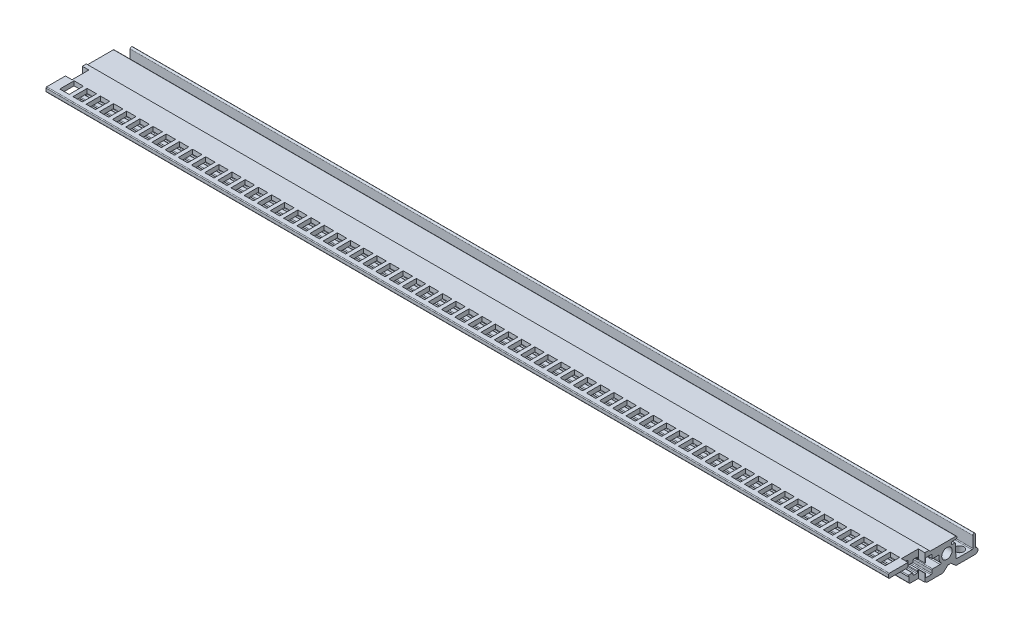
SolidWorks part; units mm, degrees
ref_plane "前视基准面" through (0, 0, 0) normal (0, 0, 1) x (1, 0, 0)
ref_plane "上视基准面" through (0, 0, 0) normal (0, 1, 0) x (1, 0, 0)
ref_plane "右视基准面" through (0, 0, 0) normal (1, 0, 0) x (0, 0, -1)
sketch "草图1" plane through (0, 0, 0) normal (1, 0, 0) x (0, 0, -1)
  line L901 (2.0061, 2.1458) -> (2.0561, 2.1458)
  line L902 (2.2561, 1.9458) -> (2.2561, -0.0542)
  line L903 (2.5561, -0.3542) -> (6.0561, -0.3542)
  line L904 (6.546, -0.7542) -> (12.6401, -0.7542)
  line L905 (12.8419, -0.6762) -> (14.6823, 0.9969)
  line L906 (15.8298, 0.9969) -> (17.6702, -0.6762)
  line L907 (17.872, -0.7542) -> (25.1561, -0.7542)
  line L908 (25.2561, 1.6874) -> (25.2561, 6.0458)
  line L909 (24.2561, 6.0458) -> (24.2561, 1.7458)
  line L910 (23.9561, 1.4458) -> (18.0561, 1.4458)
  line L911 (17.7561, 1.7458) -> (17.7561, 3.0993)
  line L912 (17.5561, 3.4458) -> (17.5561, 6.7458)
  line L913 (17.2561, 7.0458) -> (16.3561, 7.0458)
  line L914 (16.0561, 7.3458) -> (16.0561, 7.7458)
  line L915 (16.3561, 8.0458) -> (17.7561, 8.0458)
  line L916 (18.0561, 8.3458) -> (18.0561, 8.7458)
  line L917 (17.7561, 9.0458) -> (-7.9439, 9.0458)
  line L918 (-8.2439, 8.7458) -> (-8.2439, 8.1458)
  line L919 (-7.9439, 7.8458) -> (1.4561, 7.8458)
  line L920 (1.7561, 7.5458) -> (1.7561, 6.3458)
  line L921 (2.0561, 6.0458) -> (3.4561, 6.0458)
  line L922 (3.7561, 6.3458) -> (3.7561, 6.7458)
  line L923 (4.0561, 7.0458) -> (5.1561, 7.0458)
  line L924 (5.4561, 6.7458) -> (5.4561, 6.3458)
  line L925 (6.0561, 6.3458) -> (6.0561, 7.4058)
  line L926 (6.3561, 7.7058) -> (8.1561, 7.7058)
  line L927 (8.4561, 7.4058) -> (8.4561, 6.3458)
  line L928 (8.7561, 6.0458) -> (10.98, 6.0458)
  line L929 (11.646, 2.6458) -> (8.7561, 2.6458)
  line L930 (8.4561, 2.3458) -> (8.4561, 1.2858)
  line L931 (8.1561, 0.9858) -> (6.3561, 0.9858)
  line L932 (6.0561, 1.2858) -> (6.0561, 2.3458)
  line L933 (5.4561, 2.3458) -> (5.4561, 1.9458)
  line L934 (5.1561, 1.6458) -> (4.0561, 1.6458)
  line L935 (3.7561, 1.9458) -> (3.7561, 2.3458)
  line L936 (3.4561, 2.6458) -> (2.0061, 2.6458)
  circle A0 centre (14.2561, 5.0458) radius 2
  arc A133 (2.0061, 2.6458) -> (2.0061, 2.1458) centre (2.0061, 2.3958) ccw
  arc A134 (2.2561, 1.9458) -> (2.0561, 2.1458) centre (2.0561, 1.9458) ccw
  arc A135 (2.2561, -0.0542) -> (2.5561, -0.3542) centre (2.5561, -0.0542) ccw
  arc A136 (6.35, -0.5942) -> (6.0561, -0.3542) centre (6.0561, -0.6542) ccw
  arc A137 (6.35, -0.5942) -> (6.546, -0.7542) centre (6.546, -0.5542) ccw
  arc A138 (12.6401, -0.7542) -> (12.8419, -0.6762) centre (12.6401, -0.4542) ccw
  arc A139 (15.0701, 1.0103) -> (14.6823, 0.9969) centre (14.8841, 0.7749) ccw
  arc A140 (15.0701, 1.0103) -> (15.442, 1.0103) centre (15.2561, 1.2458) ccw
  arc A141 (15.8298, 0.9969) -> (15.442, 1.0103) centre (15.628, 0.7749) ccw
  arc A142 (17.6702, -0.6762) -> (17.872, -0.7542) centre (17.872, -0.4542) ccw
  arc A143 (25.1561, -0.7542) -> (25.4703, 1.3999) centre (25.1561, 0.3458) ccw
  arc A144 (25.2561, 1.6874) -> (25.4703, 1.3999) centre (25.5561, 1.6874) ccw
  arc A145 (25.2561, 6.0458) -> (24.2561, 6.0458) centre (24.7561, 6.0458) ccw
  arc A146 (23.9561, 1.4458) -> (24.2561, 1.7458) centre (23.9561, 1.7458) ccw
  arc A147 (17.7561, 1.7458) -> (18.0561, 1.4458) centre (18.0561, 1.7458) ccw
  arc A148 (17.7561, 3.0993) -> (17.6561, 3.2726) centre (17.5561, 3.0993) ccw
  arc A149 (17.5561, 3.4458) -> (17.6561, 3.2726) centre (17.7561, 3.4458) ccw
  arc A150 (17.5561, 6.7458) -> (17.2561, 7.0458) centre (17.2561, 6.7458) ccw
  arc A151 (16.0561, 7.3458) -> (16.3561, 7.0458) centre (16.3561, 7.3458) ccw
  arc A152 (16.3561, 8.0458) -> (16.0561, 7.7458) centre (16.3561, 7.7458) ccw
  arc A153 (17.7561, 8.0458) -> (18.0561, 8.3458) centre (17.7561, 8.3458) ccw
  arc A154 (18.0561, 8.7458) -> (17.7561, 9.0458) centre (17.7561, 8.7458) ccw
  arc A155 (-7.9439, 9.0458) -> (-8.2439, 8.7458) centre (-7.9439, 8.7458) ccw
  arc A156 (-8.2439, 8.1458) -> (-7.9439, 7.8458) centre (-7.9439, 8.1458) ccw
  arc A157 (1.7561, 7.5458) -> (1.4561, 7.8458) centre (1.4561, 7.5458) ccw
  arc A158 (1.7561, 6.3458) -> (2.0561, 6.0458) centre (2.0561, 6.3458) ccw
  arc A159 (3.4561, 6.0458) -> (3.7561, 6.3458) centre (3.4561, 6.3458) ccw
  arc A160 (4.0561, 7.0458) -> (3.7561, 6.7458) centre (4.0561, 6.7458) ccw
  arc A161 (5.4561, 6.7458) -> (5.1561, 7.0458) centre (5.1561, 6.7458) ccw
  arc A162 (5.4561, 6.3458) -> (6.0561, 6.3458) centre (5.7561, 6.3458) ccw
  arc A163 (6.3561, 7.7058) -> (6.0561, 7.4058) centre (6.3561, 7.4058) ccw
  arc A164 (8.4561, 7.4058) -> (8.1561, 7.7058) centre (8.1561, 7.4058) ccw
  arc A165 (8.4561, 6.3458) -> (8.7561, 6.0458) centre (8.7561, 6.3458) ccw
  arc A166 (11.2734, 5.6831) -> (10.98, 6.0458) centre (10.98, 5.7458) ccw
  arc A167 (11.2734, 5.6831) -> (11.8797, 3.1338) centre (14.2561, 5.0458) ccw
  arc A168 (11.646, 2.6458) -> (11.8797, 3.1338) centre (11.646, 2.9458) ccw
  arc A169 (8.7561, 2.6458) -> (8.4561, 2.3458) centre (8.7561, 2.3458) ccw
  arc A170 (8.1561, 0.9858) -> (8.4561, 1.2858) centre (8.1561, 1.2858) ccw
  arc A171 (6.0561, 1.2858) -> (6.3561, 0.9858) centre (6.3561, 1.2858) ccw
  arc A172 (6.0561, 2.3458) -> (5.4561, 2.3458) centre (5.7561, 2.3458) ccw
  arc A173 (5.1561, 1.6458) -> (5.4561, 1.9458) centre (5.1561, 1.9458) ccw
  arc A174 (3.7561, 1.9458) -> (4.0561, 1.6458) centre (4.0561, 1.9458) ccw
  arc A175 (3.7561, 2.3458) -> (3.4561, 2.6458) centre (3.4561, 2.3458) ccw
  dimension "D2" = 0.3
  dimension "D3" = 0.3
  dimension "D6" = 4
  dimension "D1" = 0.6
  dimension "D4" = 25.7
  dimension "D5" = 9.4
extrude "凸台-拉伸1" add sketch "草图1" along normal mid plane 325.12
sketch "草图7" plane through (162.56, 0, 0) normal (1, 0, 0) x (0, 0, -1)
  line L0 (-7.9439, 9.0458) -> (-8.2439, 9.0458)
  line L1 (-8.2439, 9.0458) -> (-8.2439, 8.7458)
  arc A0 (-7.9439, 9.0458) -> (-8.2439, 8.7458) centre (-7.9439, 8.7458) ccw construction
  arc A1 (-7.9439, 9.0458) -> (-8.2439, 8.7458) centre (-7.9439, 8.7458) ccw
extrude "凸台-拉伸4" add sketch "草图7" against normal through all
sketch "草图6" plane through (-162.56, 0, 0) normal (-1, 0, 0) x (0, 0, 1)
  line L0 (-7.8061, 9.0458) -> (8.2439, 9.0458)
  line L1 (-17.7561, 9.0458) -> (8.2439, 9.0458) construction
  line L4 (8.2439, 9.0458) -> (8.2439, 9.5458)
  line L5 (8.2439, 9.5458) -> (-7.3061, 9.5458)
  line L6 (-7.3061, 9.5458) -> (-7.8061, 9.0458)
extrude "凸台-拉伸3" add sketch "草图6" against normal through all
sketch "草图3" plane through (0, 9.5458, 0) normal (0, 1, 0) x (1, 0, 0)
  line L0 (162.56, 17.7561) -> (162.56, 7.8061) construction
  line L1 (162.56, 5.7561) -> (160.02, 5.7561)
  line L2 (162.56, 5.7561) -> (162.56, -0.7439)
  line L3 (162.56, -0.7439) -> (160.02, -0.7439)
  line L4 (160.02, 5.7561) -> (160.02, -0.7439)
  line L5 (162.56, -8.2439) -> (-162.56, -8.2439) construction
  line L7 (0, -8.2439) -> (0, 17.7561) construction
  line L9 (162.56, 17.7561) -> (-162.56, 17.7561) construction
  line L10 (-160.02, 5.7561) -> (-160.02, -0.7439)
  line L11 (-162.56, -0.7439) -> (-160.02, -0.7439)
  line L12 (-162.56, 5.7561) -> (-162.56, -0.7439)
  line L13 (-162.56, 5.7561) -> (-160.02, 5.7561)
  dimension "D1" = 2.54
  dimension "D2" = 7.5
  dimension "D3" = 6.5
extrude "切除-拉伸1" cut sketch "草图3" against normal up to surface (10.3 mm away)
sketch "草图4" plane through (0, -0.7542, 0) normal (0, -1, 0) x (-1, 0, 0)
  line L0 (-160.02, 1.7561) -> (160.02, 1.7561) construction
  line L1 (-162.56, 17.872) -> (-162.56, 25.1561) construction
  circle A0 centre (-160.02, 21.7061) radius 1.65
  circle A1 centre (-154.94, 21.7061) radius 1.65
  circle A2 centre (-149.86, 21.7061) radius 1.65
  circle A3 centre (-144.78, 21.7061) radius 1.65
  circle A4 centre (-139.7, 21.7061) radius 1.65
  circle A5 centre (-134.62, 21.7061) radius 1.65
  circle A6 centre (-129.54, 21.7061) radius 1.65
  circle A7 centre (-124.46, 21.7061) radius 1.65
  circle A8 centre (-119.38, 21.7061) radius 1.65
  circle A9 centre (-114.3, 21.7061) radius 1.65
  circle A10 centre (-109.22, 21.7061) radius 1.65
  circle A11 centre (-104.14, 21.7061) radius 1.65
  circle A12 centre (-99.06, 21.7061) radius 1.65
  circle A13 centre (-93.98, 21.7061) radius 1.65
  circle A14 centre (-88.9, 21.7061) radius 1.65
  circle A15 centre (-83.82, 21.7061) radius 1.65
  circle A16 centre (-78.74, 21.7061) radius 1.65
  circle A17 centre (-73.66, 21.7061) radius 1.65
  circle A18 centre (-68.58, 21.7061) radius 1.65
  circle A19 centre (-63.5, 21.7061) radius 1.65
  circle A20 centre (-58.42, 21.7061) radius 1.65
  circle A21 centre (-53.34, 21.7061) radius 1.65
  circle A22 centre (-48.26, 21.7061) radius 1.65
  circle A23 centre (-43.18, 21.7061) radius 1.65
  circle A24 centre (-38.1, 21.7061) radius 1.65
  circle A25 centre (-33.02, 21.7061) radius 1.65
  circle A26 centre (-27.94, 21.7061) radius 1.65
  circle A27 centre (-22.86, 21.7061) radius 1.65
  circle A28 centre (-17.78, 21.7061) radius 1.65
  circle A29 centre (-12.7, 21.7061) radius 1.65
  circle A30 centre (-7.62, 21.7061) radius 1.65
  circle A31 centre (-2.54, 21.7061) radius 1.65
  circle A32 centre (2.54, 21.7061) radius 1.65
  circle A33 centre (7.62, 21.7061) radius 1.65
  circle A34 centre (12.7, 21.7061) radius 1.65
  circle A35 centre (17.78, 21.7061) radius 1.65
  circle A36 centre (22.86, 21.7061) radius 1.65
  circle A37 centre (27.94, 21.7061) radius 1.65
  circle A38 centre (33.02, 21.7061) radius 1.65
  circle A39 centre (38.1, 21.7061) radius 1.65
  circle A40 centre (43.18, 21.7061) radius 1.65
  circle A41 centre (48.26, 21.7061) radius 1.65
  circle A42 centre (53.34, 21.7061) radius 1.65
  circle A43 centre (58.42, 21.7061) radius 1.65
  circle A44 centre (63.5, 21.7061) radius 1.65
  circle A45 centre (68.58, 21.7061) radius 1.65
  circle A46 centre (73.66, 21.7061) radius 1.65
  circle A47 centre (78.74, 21.7061) radius 1.65
  circle A48 centre (83.82, 21.7061) radius 1.65
  circle A49 centre (88.9, 21.7061) radius 1.65
  circle A50 centre (93.98, 21.7061) radius 1.65
  circle A51 centre (99.06, 21.7061) radius 1.65
  circle A52 centre (104.14, 21.7061) radius 1.65
  circle A53 centre (109.22, 21.7061) radius 1.65
  circle A54 centre (114.3, 21.7061) radius 1.65
  circle A55 centre (119.38, 21.7061) radius 1.65
  circle A56 centre (124.46, 21.7061) radius 1.65
  circle A57 centre (129.54, 21.7061) radius 1.65
  circle A58 centre (134.62, 21.7061) radius 1.65
  circle A59 centre (139.7, 21.7061) radius 1.65
  circle A60 centre (144.78, 21.7061) radius 1.65
  circle A61 centre (149.86, 21.7061) radius 1.65
  circle A62 centre (154.94, 21.7061) radius 1.65
  circle A63 centre (160.02, 21.7061) radius 1.65
extrude "切除-拉伸2" cut sketch "草图4" against normal up to surface (9.8 mm away)
sketch "草图5" plane through (0, 9.5458, 0) normal (0, 1, 0) x (1, 0, 0)
  line L0 (-162.56, 17.7561) -> (-162.56, 7.8061) construction
  line L1 (-155.68, -6.1939) -> (-159.28, -6.1939)
  line L2 (-155.68, -6.1939) -> (-155.68, -0.6939)
  line L3 (-155.68, -0.6939) -> (-159.28, -0.6939)
  line L4 (-159.28, -6.1939) -> (-159.28, -0.6939)
  line L5 (-155.68, -6.1939) -> (-159.28, -0.6939) construction
  line L6 (-155.68, -0.6939) -> (-159.28, -6.1939) construction
  line L8 (-150.6, -6.1939) -> (-154.2, -6.1939)
  line L9 (-150.6, -6.1939) -> (-150.6, -0.6939)
  line L10 (-150.6, -0.6939) -> (-154.2, -0.6939)
  line L11 (-154.2, -6.1939) -> (-154.2, -0.6939)
  line L12 (-150.6, -6.1939) -> (-154.2, -0.6939) construction
  line L13 (-150.6, -0.6939) -> (-154.2, -6.1939) construction
  line L14 (-145.52, -6.1939) -> (-149.12, -6.1939)
  line L15 (-145.52, -6.1939) -> (-145.52, -0.6939)
  line L16 (-145.52, -0.6939) -> (-149.12, -0.6939)
  line L17 (-149.12, -6.1939) -> (-149.12, -0.6939)
  line L18 (-145.52, -6.1939) -> (-149.12, -0.6939) construction
  line L19 (-145.52, -0.6939) -> (-149.12, -6.1939) construction
  line L20 (-140.44, -6.1939) -> (-144.04, -6.1939)
  line L21 (-140.44, -6.1939) -> (-140.44, -0.6939)
  line L22 (-140.44, -0.6939) -> (-144.04, -0.6939)
  line L23 (-144.04, -6.1939) -> (-144.04, -0.6939)
  line L24 (-140.44, -6.1939) -> (-144.04, -0.6939) construction
  line L25 (-140.44, -0.6939) -> (-144.04, -6.1939) construction
  line L26 (-135.36, -6.1939) -> (-138.96, -6.1939)
  line L27 (-135.36, -6.1939) -> (-135.36, -0.6939)
  line L28 (-135.36, -0.6939) -> (-138.96, -0.6939)
  line L29 (-138.96, -6.1939) -> (-138.96, -0.6939)
  line L30 (-135.36, -6.1939) -> (-138.96, -0.6939) construction
  line L31 (-135.36, -0.6939) -> (-138.96, -6.1939) construction
  line L32 (-130.28, -6.1939) -> (-133.88, -6.1939)
  line L33 (-130.28, -6.1939) -> (-130.28, -0.6939)
  line L34 (-130.28, -0.6939) -> (-133.88, -0.6939)
  line L35 (-133.88, -6.1939) -> (-133.88, -0.6939)
  line L36 (-130.28, -6.1939) -> (-133.88, -0.6939) construction
  line L37 (-130.28, -0.6939) -> (-133.88, -6.1939) construction
  line L38 (-125.2, -6.1939) -> (-128.8, -6.1939)
  line L39 (-125.2, -6.1939) -> (-125.2, -0.6939)
  line L40 (-125.2, -0.6939) -> (-128.8, -0.6939)
  line L41 (-128.8, -6.1939) -> (-128.8, -0.6939)
  line L42 (-125.2, -6.1939) -> (-128.8, -0.6939) construction
  line L43 (-125.2, -0.6939) -> (-128.8, -6.1939) construction
  line L44 (-120.12, -6.1939) -> (-123.72, -6.1939)
  line L45 (-120.12, -6.1939) -> (-120.12, -0.6939)
  line L46 (-120.12, -0.6939) -> (-123.72, -0.6939)
  line L47 (-123.72, -6.1939) -> (-123.72, -0.6939)
  line L48 (-120.12, -6.1939) -> (-123.72, -0.6939) construction
  line L49 (-120.12, -0.6939) -> (-123.72, -6.1939) construction
  line L50 (-115.04, -6.1939) -> (-118.64, -6.1939)
  line L51 (-115.04, -6.1939) -> (-115.04, -0.6939)
  line L52 (-115.04, -0.6939) -> (-118.64, -0.6939)
  line L53 (-118.64, -6.1939) -> (-118.64, -0.6939)
  line L54 (-115.04, -6.1939) -> (-118.64, -0.6939) construction
  line L55 (-115.04, -0.6939) -> (-118.64, -6.1939) construction
  line L56 (-109.96, -6.1939) -> (-113.56, -6.1939)
  line L57 (-109.96, -6.1939) -> (-109.96, -0.6939)
  line L58 (-109.96, -0.6939) -> (-113.56, -0.6939)
  line L59 (-113.56, -6.1939) -> (-113.56, -0.6939)
  line L60 (-109.96, -6.1939) -> (-113.56, -0.6939) construction
  line L61 (-109.96, -0.6939) -> (-113.56, -6.1939) construction
  line L62 (-104.88, -6.1939) -> (-108.48, -6.1939)
  line L63 (-104.88, -6.1939) -> (-104.88, -0.6939)
  line L64 (-104.88, -0.6939) -> (-108.48, -0.6939)
  line L65 (-108.48, -6.1939) -> (-108.48, -0.6939)
  line L66 (-104.88, -6.1939) -> (-108.48, -0.6939) construction
  line L67 (-104.88, -0.6939) -> (-108.48, -6.1939) construction
  line L68 (-99.8, -6.1939) -> (-103.4, -6.1939)
  line L69 (-99.8, -6.1939) -> (-99.8, -0.6939)
  line L70 (-99.8, -0.6939) -> (-103.4, -0.6939)
  line L71 (-103.4, -6.1939) -> (-103.4, -0.6939)
  line L72 (-99.8, -6.1939) -> (-103.4, -0.6939) construction
  line L73 (-99.8, -0.6939) -> (-103.4, -6.1939) construction
  line L74 (-94.72, -6.1939) -> (-98.32, -6.1939)
  line L75 (-94.72, -6.1939) -> (-94.72, -0.6939)
  line L76 (-94.72, -0.6939) -> (-98.32, -0.6939)
  line L77 (-98.32, -6.1939) -> (-98.32, -0.6939)
  line L78 (-94.72, -6.1939) -> (-98.32, -0.6939) construction
  line L79 (-94.72, -0.6939) -> (-98.32, -6.1939) construction
  line L80 (-89.64, -6.1939) -> (-93.24, -6.1939)
  line L81 (-89.64, -6.1939) -> (-89.64, -0.6939)
  line L82 (-89.64, -0.6939) -> (-93.24, -0.6939)
  line L83 (-93.24, -6.1939) -> (-93.24, -0.6939)
  line L84 (-89.64, -6.1939) -> (-93.24, -0.6939) construction
  line L85 (-89.64, -0.6939) -> (-93.24, -6.1939) construction
  line L86 (-84.56, -6.1939) -> (-88.16, -6.1939)
  line L87 (-84.56, -6.1939) -> (-84.56, -0.6939)
  line L88 (-84.56, -0.6939) -> (-88.16, -0.6939)
  line L89 (-88.16, -6.1939) -> (-88.16, -0.6939)
  line L90 (-84.56, -6.1939) -> (-88.16, -0.6939) construction
  line L91 (-84.56, -0.6939) -> (-88.16, -6.1939) construction
  line L92 (-79.48, -6.1939) -> (-83.08, -6.1939)
  line L93 (-79.48, -6.1939) -> (-79.48, -0.6939)
  line L94 (-79.48, -0.6939) -> (-83.08, -0.6939)
  line L95 (-83.08, -6.1939) -> (-83.08, -0.6939)
  line L96 (-79.48, -6.1939) -> (-83.08, -0.6939) construction
  line L97 (-79.48, -0.6939) -> (-83.08, -6.1939) construction
  line L98 (-74.4, -6.1939) -> (-78, -6.1939)
  line L99 (-74.4, -6.1939) -> (-74.4, -0.6939)
  line L100 (-74.4, -0.6939) -> (-78, -0.6939)
  line L101 (-78, -6.1939) -> (-78, -0.6939)
  line L102 (-74.4, -6.1939) -> (-78, -0.6939) construction
  line L103 (-74.4, -0.6939) -> (-78, -6.1939) construction
  line L104 (-69.32, -6.1939) -> (-72.92, -6.1939)
  line L105 (-69.32, -6.1939) -> (-69.32, -0.6939)
  line L106 (-69.32, -0.6939) -> (-72.92, -0.6939)
  line L107 (-72.92, -6.1939) -> (-72.92, -0.6939)
  line L108 (-69.32, -6.1939) -> (-72.92, -0.6939) construction
  line L109 (-69.32, -0.6939) -> (-72.92, -6.1939) construction
  line L110 (-64.24, -6.1939) -> (-67.84, -6.1939)
  line L111 (-64.24, -6.1939) -> (-64.24, -0.6939)
  line L112 (-64.24, -0.6939) -> (-67.84, -0.6939)
  line L113 (-67.84, -6.1939) -> (-67.84, -0.6939)
  line L114 (-64.24, -6.1939) -> (-67.84, -0.6939) construction
  line L115 (-64.24, -0.6939) -> (-67.84, -6.1939) construction
  line L116 (-59.16, -6.1939) -> (-62.76, -6.1939)
  line L117 (-59.16, -6.1939) -> (-59.16, -0.6939)
  line L118 (-59.16, -0.6939) -> (-62.76, -0.6939)
  line L119 (-62.76, -6.1939) -> (-62.76, -0.6939)
  line L120 (-59.16, -6.1939) -> (-62.76, -0.6939) construction
  line L121 (-59.16, -0.6939) -> (-62.76, -6.1939) construction
  line L122 (-54.08, -6.1939) -> (-57.68, -6.1939)
  line L123 (-54.08, -6.1939) -> (-54.08, -0.6939)
  line L124 (-54.08, -0.6939) -> (-57.68, -0.6939)
  line L125 (-57.68, -6.1939) -> (-57.68, -0.6939)
  line L126 (-54.08, -6.1939) -> (-57.68, -0.6939) construction
  line L127 (-54.08, -0.6939) -> (-57.68, -6.1939) construction
  line L128 (-49, -6.1939) -> (-52.6, -6.1939)
  line L129 (-49, -6.1939) -> (-49, -0.6939)
  line L130 (-49, -0.6939) -> (-52.6, -0.6939)
  line L131 (-52.6, -6.1939) -> (-52.6, -0.6939)
  line L132 (-49, -6.1939) -> (-52.6, -0.6939) construction
  line L133 (-49, -0.6939) -> (-52.6, -6.1939) construction
  line L134 (-43.92, -6.1939) -> (-47.52, -6.1939)
  line L135 (-43.92, -6.1939) -> (-43.92, -0.6939)
  line L136 (-43.92, -0.6939) -> (-47.52, -0.6939)
  line L137 (-47.52, -6.1939) -> (-47.52, -0.6939)
  line L138 (-43.92, -6.1939) -> (-47.52, -0.6939) construction
  line L139 (-43.92, -0.6939) -> (-47.52, -6.1939) construction
  line L140 (-38.84, -6.1939) -> (-42.44, -6.1939)
  line L141 (-38.84, -6.1939) -> (-38.84, -0.6939)
  line L142 (-38.84, -0.6939) -> (-42.44, -0.6939)
  line L143 (-42.44, -6.1939) -> (-42.44, -0.6939)
  line L144 (-38.84, -6.1939) -> (-42.44, -0.6939) construction
  line L145 (-38.84, -0.6939) -> (-42.44, -6.1939) construction
  line L146 (-33.76, -6.1939) -> (-37.36, -6.1939)
  line L147 (-33.76, -6.1939) -> (-33.76, -0.6939)
  line L148 (-33.76, -0.6939) -> (-37.36, -0.6939)
  line L149 (-37.36, -6.1939) -> (-37.36, -0.6939)
  line L150 (-33.76, -6.1939) -> (-37.36, -0.6939) construction
  line L151 (-33.76, -0.6939) -> (-37.36, -6.1939) construction
  line L152 (-28.68, -6.1939) -> (-32.28, -6.1939)
  line L153 (-28.68, -6.1939) -> (-28.68, -0.6939)
  line L154 (-28.68, -0.6939) -> (-32.28, -0.6939)
  line L155 (-32.28, -6.1939) -> (-32.28, -0.6939)
  line L156 (-28.68, -6.1939) -> (-32.28, -0.6939) construction
  line L157 (-28.68, -0.6939) -> (-32.28, -6.1939) construction
  line L158 (-23.6, -6.1939) -> (-27.2, -6.1939)
  line L159 (-23.6, -6.1939) -> (-23.6, -0.6939)
  line L160 (-23.6, -0.6939) -> (-27.2, -0.6939)
  line L161 (-27.2, -6.1939) -> (-27.2, -0.6939)
  line L162 (-23.6, -6.1939) -> (-27.2, -0.6939) construction
  line L163 (-23.6, -0.6939) -> (-27.2, -6.1939) construction
  line L164 (-18.52, -6.1939) -> (-22.12, -6.1939)
  line L165 (-18.52, -6.1939) -> (-18.52, -0.6939)
  line L166 (-18.52, -0.6939) -> (-22.12, -0.6939)
  line L167 (-22.12, -6.1939) -> (-22.12, -0.6939)
  line L168 (-18.52, -6.1939) -> (-22.12, -0.6939) construction
  line L169 (-18.52, -0.6939) -> (-22.12, -6.1939) construction
  line L170 (-13.44, -6.1939) -> (-17.04, -6.1939)
  line L171 (-13.44, -6.1939) -> (-13.44, -0.6939)
  line L172 (-13.44, -0.6939) -> (-17.04, -0.6939)
  line L173 (-17.04, -6.1939) -> (-17.04, -0.6939)
  line L174 (-13.44, -6.1939) -> (-17.04, -0.6939) construction
  line L175 (-13.44, -0.6939) -> (-17.04, -6.1939) construction
  line L176 (-8.36, -6.1939) -> (-11.96, -6.1939)
  line L177 (-8.36, -6.1939) -> (-8.36, -0.6939)
  line L178 (-8.36, -0.6939) -> (-11.96, -0.6939)
  line L179 (-11.96, -6.1939) -> (-11.96, -0.6939)
  line L180 (-8.36, -6.1939) -> (-11.96, -0.6939) construction
  line L181 (-8.36, -0.6939) -> (-11.96, -6.1939) construction
  line L182 (-3.28, -6.1939) -> (-6.88, -6.1939)
  line L183 (-3.28, -6.1939) -> (-3.28, -0.6939)
  line L184 (-3.28, -0.6939) -> (-6.88, -0.6939)
  line L185 (-6.88, -6.1939) -> (-6.88, -0.6939)
  line L186 (-3.28, -6.1939) -> (-6.88, -0.6939) construction
  line L187 (-3.28, -0.6939) -> (-6.88, -6.1939) construction
  line L188 (1.8, -6.1939) -> (-1.8, -6.1939)
  line L189 (1.8, -6.1939) -> (1.8, -0.6939)
  line L190 (1.8, -0.6939) -> (-1.8, -0.6939)
  line L191 (-1.8, -6.1939) -> (-1.8, -0.6939)
  line L192 (1.8, -6.1939) -> (-1.8, -0.6939) construction
  line L193 (1.8, -0.6939) -> (-1.8, -6.1939) construction
  line L194 (6.88, -6.1939) -> (3.28, -6.1939)
  line L195 (6.88, -6.1939) -> (6.88, -0.6939)
  line L196 (6.88, -0.6939) -> (3.28, -0.6939)
  line L197 (3.28, -6.1939) -> (3.28, -0.6939)
  line L198 (6.88, -6.1939) -> (3.28, -0.6939) construction
  line L199 (6.88, -0.6939) -> (3.28, -6.1939) construction
  line L200 (11.96, -6.1939) -> (8.36, -6.1939)
  line L201 (11.96, -6.1939) -> (11.96, -0.6939)
  line L202 (11.96, -0.6939) -> (8.36, -0.6939)
  line L203 (8.36, -6.1939) -> (8.36, -0.6939)
  line L204 (11.96, -6.1939) -> (8.36, -0.6939) construction
  line L205 (11.96, -0.6939) -> (8.36, -6.1939) construction
  line L206 (17.04, -6.1939) -> (13.44, -6.1939)
  line L207 (17.04, -6.1939) -> (17.04, -0.6939)
  line L208 (17.04, -0.6939) -> (13.44, -0.6939)
  line L209 (13.44, -6.1939) -> (13.44, -0.6939)
  line L210 (17.04, -6.1939) -> (13.44, -0.6939) construction
  line L211 (17.04, -0.6939) -> (13.44, -6.1939) construction
  line L212 (22.12, -6.1939) -> (18.52, -6.1939)
  line L213 (22.12, -6.1939) -> (22.12, -0.6939)
  line L214 (22.12, -0.6939) -> (18.52, -0.6939)
  line L215 (18.52, -6.1939) -> (18.52, -0.6939)
  line L216 (22.12, -6.1939) -> (18.52, -0.6939) construction
  line L217 (22.12, -0.6939) -> (18.52, -6.1939) construction
  line L218 (27.2, -6.1939) -> (23.6, -6.1939)
  line L219 (27.2, -6.1939) -> (27.2, -0.6939)
  line L220 (27.2, -0.6939) -> (23.6, -0.6939)
  line L221 (23.6, -6.1939) -> (23.6, -0.6939)
  line L222 (27.2, -6.1939) -> (23.6, -0.6939) construction
  line L223 (27.2, -0.6939) -> (23.6, -6.1939) construction
  line L224 (32.28, -6.1939) -> (28.68, -6.1939)
  line L225 (32.28, -6.1939) -> (32.28, -0.6939)
  line L226 (32.28, -0.6939) -> (28.68, -0.6939)
  line L227 (28.68, -6.1939) -> (28.68, -0.6939)
  line L228 (32.28, -6.1939) -> (28.68, -0.6939) construction
  line L229 (32.28, -0.6939) -> (28.68, -6.1939) construction
  line L230 (37.36, -6.1939) -> (33.76, -6.1939)
  line L231 (37.36, -6.1939) -> (37.36, -0.6939)
  line L232 (37.36, -0.6939) -> (33.76, -0.6939)
  line L233 (33.76, -6.1939) -> (33.76, -0.6939)
  line L234 (37.36, -6.1939) -> (33.76, -0.6939) construction
  line L235 (37.36, -0.6939) -> (33.76, -6.1939) construction
  line L236 (42.44, -6.1939) -> (38.84, -6.1939)
  line L237 (42.44, -6.1939) -> (42.44, -0.6939)
  line L238 (42.44, -0.6939) -> (38.84, -0.6939)
  line L239 (38.84, -6.1939) -> (38.84, -0.6939)
  line L240 (42.44, -6.1939) -> (38.84, -0.6939) construction
  line L241 (42.44, -0.6939) -> (38.84, -6.1939) construction
  line L242 (47.52, -6.1939) -> (43.92, -6.1939)
  line L243 (47.52, -6.1939) -> (47.52, -0.6939)
  line L244 (47.52, -0.6939) -> (43.92, -0.6939)
  line L245 (43.92, -6.1939) -> (43.92, -0.6939)
  line L246 (47.52, -6.1939) -> (43.92, -0.6939) construction
  line L247 (47.52, -0.6939) -> (43.92, -6.1939) construction
  line L248 (52.6, -6.1939) -> (49, -6.1939)
  line L249 (52.6, -6.1939) -> (52.6, -0.6939)
  line L250 (52.6, -0.6939) -> (49, -0.6939)
  line L251 (49, -6.1939) -> (49, -0.6939)
  line L252 (52.6, -6.1939) -> (49, -0.6939) construction
  line L253 (52.6, -0.6939) -> (49, -6.1939) construction
  line L254 (57.68, -6.1939) -> (54.08, -6.1939)
  line L255 (57.68, -6.1939) -> (57.68, -0.6939)
  line L256 (57.68, -0.6939) -> (54.08, -0.6939)
  line L257 (54.08, -6.1939) -> (54.08, -0.6939)
  line L258 (57.68, -6.1939) -> (54.08, -0.6939) construction
  line L259 (57.68, -0.6939) -> (54.08, -6.1939) construction
  line L260 (62.76, -6.1939) -> (59.16, -6.1939)
  line L261 (62.76, -6.1939) -> (62.76, -0.6939)
  line L262 (62.76, -0.6939) -> (59.16, -0.6939)
  line L263 (59.16, -6.1939) -> (59.16, -0.6939)
  line L264 (62.76, -6.1939) -> (59.16, -0.6939) construction
  line L265 (62.76, -0.6939) -> (59.16, -6.1939) construction
  line L266 (67.84, -6.1939) -> (64.24, -6.1939)
  line L267 (67.84, -6.1939) -> (67.84, -0.6939)
  line L268 (67.84, -0.6939) -> (64.24, -0.6939)
  line L269 (64.24, -6.1939) -> (64.24, -0.6939)
  line L270 (67.84, -6.1939) -> (64.24, -0.6939) construction
  line L271 (67.84, -0.6939) -> (64.24, -6.1939) construction
  line L272 (72.92, -6.1939) -> (69.32, -6.1939)
  line L273 (72.92, -6.1939) -> (72.92, -0.6939)
  line L274 (72.92, -0.6939) -> (69.32, -0.6939)
  line L275 (69.32, -6.1939) -> (69.32, -0.6939)
  line L276 (72.92, -6.1939) -> (69.32, -0.6939) construction
  line L277 (72.92, -0.6939) -> (69.32, -6.1939) construction
  line L278 (78, -6.1939) -> (74.4, -6.1939)
  line L279 (78, -6.1939) -> (78, -0.6939)
  line L280 (78, -0.6939) -> (74.4, -0.6939)
  line L281 (74.4, -6.1939) -> (74.4, -0.6939)
  line L282 (78, -6.1939) -> (74.4, -0.6939) construction
  line L283 (78, -0.6939) -> (74.4, -6.1939) construction
  line L284 (83.08, -6.1939) -> (79.48, -6.1939)
  line L285 (83.08, -6.1939) -> (83.08, -0.6939)
  line L286 (83.08, -0.6939) -> (79.48, -0.6939)
  line L287 (79.48, -6.1939) -> (79.48, -0.6939)
  line L288 (83.08, -6.1939) -> (79.48, -0.6939) construction
  line L289 (83.08, -0.6939) -> (79.48, -6.1939) construction
  line L290 (88.16, -6.1939) -> (84.56, -6.1939)
  line L291 (88.16, -6.1939) -> (88.16, -0.6939)
  line L292 (88.16, -0.6939) -> (84.56, -0.6939)
  line L293 (84.56, -6.1939) -> (84.56, -0.6939)
  line L294 (88.16, -6.1939) -> (84.56, -0.6939) construction
  line L295 (88.16, -0.6939) -> (84.56, -6.1939) construction
  line L296 (93.24, -6.1939) -> (89.64, -6.1939)
  line L297 (93.24, -6.1939) -> (93.24, -0.6939)
  line L298 (93.24, -0.6939) -> (89.64, -0.6939)
  line L299 (89.64, -6.1939) -> (89.64, -0.6939)
  line L300 (93.24, -6.1939) -> (89.64, -0.6939) construction
  line L301 (93.24, -0.6939) -> (89.64, -6.1939) construction
  line L302 (98.32, -6.1939) -> (94.72, -6.1939)
  line L303 (98.32, -6.1939) -> (98.32, -0.6939)
  line L304 (98.32, -0.6939) -> (94.72, -0.6939)
  line L305 (94.72, -6.1939) -> (94.72, -0.6939)
  line L306 (98.32, -6.1939) -> (94.72, -0.6939) construction
  line L307 (98.32, -0.6939) -> (94.72, -6.1939) construction
  line L308 (103.4, -6.1939) -> (99.8, -6.1939)
  line L309 (103.4, -6.1939) -> (103.4, -0.6939)
  line L310 (103.4, -0.6939) -> (99.8, -0.6939)
  line L311 (99.8, -6.1939) -> (99.8, -0.6939)
  line L312 (103.4, -6.1939) -> (99.8, -0.6939) construction
  line L313 (103.4, -0.6939) -> (99.8, -6.1939) construction
  line L314 (108.48, -6.1939) -> (104.88, -6.1939)
  line L315 (108.48, -6.1939) -> (108.48, -0.6939)
  line L316 (108.48, -0.6939) -> (104.88, -0.6939)
  line L317 (104.88, -6.1939) -> (104.88, -0.6939)
  line L318 (108.48, -6.1939) -> (104.88, -0.6939) construction
  line L319 (108.48, -0.6939) -> (104.88, -6.1939) construction
  line L320 (113.56, -6.1939) -> (109.96, -6.1939)
  line L321 (113.56, -6.1939) -> (113.56, -0.6939)
  line L322 (113.56, -0.6939) -> (109.96, -0.6939)
  line L323 (109.96, -6.1939) -> (109.96, -0.6939)
  line L324 (113.56, -6.1939) -> (109.96, -0.6939) construction
  line L325 (113.56, -0.6939) -> (109.96, -6.1939) construction
  line L326 (118.64, -6.1939) -> (115.04, -6.1939)
  line L327 (118.64, -6.1939) -> (118.64, -0.6939)
  line L328 (118.64, -0.6939) -> (115.04, -0.6939)
  line L329 (115.04, -6.1939) -> (115.04, -0.6939)
  line L330 (118.64, -6.1939) -> (115.04, -0.6939) construction
  line L331 (118.64, -0.6939) -> (115.04, -6.1939) construction
  line L332 (123.72, -6.1939) -> (120.12, -6.1939)
  line L333 (123.72, -6.1939) -> (123.72, -0.6939)
  line L334 (123.72, -0.6939) -> (120.12, -0.6939)
  line L335 (120.12, -6.1939) -> (120.12, -0.6939)
  line L336 (123.72, -6.1939) -> (120.12, -0.6939) construction
  line L337 (123.72, -0.6939) -> (120.12, -6.1939) construction
  line L338 (128.8, -6.1939) -> (125.2, -6.1939)
  line L339 (128.8, -6.1939) -> (128.8, -0.6939)
  line L340 (128.8, -0.6939) -> (125.2, -0.6939)
  line L341 (125.2, -6.1939) -> (125.2, -0.6939)
  line L342 (128.8, -6.1939) -> (125.2, -0.6939) construction
  line L343 (128.8, -0.6939) -> (125.2, -6.1939) construction
  line L344 (133.88, -6.1939) -> (130.28, -6.1939)
  line L345 (133.88, -6.1939) -> (133.88, -0.6939)
  line L346 (133.88, -0.6939) -> (130.28, -0.6939)
  line L347 (130.28, -6.1939) -> (130.28, -0.6939)
  line L348 (133.88, -6.1939) -> (130.28, -0.6939) construction
  line L349 (133.88, -0.6939) -> (130.28, -6.1939) construction
  line L350 (138.96, -6.1939) -> (135.36, -6.1939)
  line L351 (138.96, -6.1939) -> (138.96, -0.6939)
  line L352 (138.96, -0.6939) -> (135.36, -0.6939)
  line L353 (135.36, -6.1939) -> (135.36, -0.6939)
  line L354 (138.96, -6.1939) -> (135.36, -0.6939) construction
  line L355 (138.96, -0.6939) -> (135.36, -6.1939) construction
  line L356 (144.04, -6.1939) -> (140.44, -6.1939)
  line L357 (144.04, -6.1939) -> (144.04, -0.6939)
  line L358 (144.04, -0.6939) -> (140.44, -0.6939)
  line L359 (140.44, -6.1939) -> (140.44, -0.6939)
  line L360 (144.04, -6.1939) -> (140.44, -0.6939) construction
  line L361 (144.04, -0.6939) -> (140.44, -6.1939) construction
  line L362 (149.12, -6.1939) -> (145.52, -6.1939)
  line L363 (149.12, -6.1939) -> (149.12, -0.6939)
  line L364 (149.12, -0.6939) -> (145.52, -0.6939)
  line L365 (145.52, -6.1939) -> (145.52, -0.6939)
  line L366 (149.12, -6.1939) -> (145.52, -0.6939) construction
  line L367 (149.12, -0.6939) -> (145.52, -6.1939) construction
  line L368 (154.2, -6.1939) -> (150.6, -6.1939)
  line L369 (154.2, -6.1939) -> (154.2, -0.6939)
  line L370 (154.2, -0.6939) -> (150.6, -0.6939)
  line L371 (150.6, -6.1939) -> (150.6, -0.6939)
  line L372 (154.2, -6.1939) -> (150.6, -0.6939) construction
  line L373 (154.2, -0.6939) -> (150.6, -6.1939) construction
  line L374 (159.28, -6.1939) -> (155.68, -6.1939)
  line L375 (159.28, -6.1939) -> (159.28, -0.6939)
  line L376 (159.28, -0.6939) -> (155.68, -0.6939)
  line L377 (155.68, -6.1939) -> (155.68, -0.6939)
  line L378 (159.28, -6.1939) -> (155.68, -0.6939) construction
  line L379 (159.28, -0.6939) -> (155.68, -6.1939) construction
  line L506 (162.56, -8.2439) -> (-162.56, -8.2439) construction
  point P0 (-157.48, -3.4439)
  point P10 (-152.4, -3.4439)
  point P15 (-147.32, -3.4439)
  point P20 (-142.24, -3.4439)
  point P25 (-137.16, -3.4439)
  point P30 (-132.08, -3.4439)
  point P35 (-127, -3.4439)
  point P40 (-121.92, -3.4439)
  point P45 (-116.84, -3.4439)
  point P50 (-111.76, -3.4439)
  point P55 (-106.68, -3.4439)
  point P60 (-101.6, -3.4439)
  point P65 (-96.52, -3.4439)
  point P70 (-91.44, -3.4439)
  point P75 (-86.36, -3.4439)
  point P80 (-81.28, -3.4439)
  point P85 (-76.2, -3.4439)
  point P90 (-71.12, -3.4439)
  point P95 (-66.04, -3.4439)
  point P100 (-60.96, -3.4439)
  point P105 (-55.88, -3.4439)
  point P110 (-50.8, -3.4439)
  point P115 (-45.72, -3.4439)
  point P120 (-40.64, -3.4439)
  point P125 (-35.56, -3.4439)
  point P130 (-30.48, -3.4439)
  point P135 (-25.4, -3.4439)
  point P140 (-20.32, -3.4439)
  point P145 (-15.24, -3.4439)
  point P150 (-10.16, -3.4439)
  point P155 (-5.08, -3.4439)
  point P160 (0, -3.4439)
  point P165 (5.08, -3.4439)
  point P170 (10.16, -3.4439)
  point P175 (15.24, -3.4439)
  point P180 (20.32, -3.4439)
  point P185 (25.4, -3.4439)
  point P190 (30.48, -3.4439)
  point P195 (35.56, -3.4439)
  point P200 (40.64, -3.4439)
  point P205 (45.72, -3.4439)
  point P210 (50.8, -3.4439)
  point P215 (55.88, -3.4439)
  point P220 (60.96, -3.4439)
  point P225 (66.04, -3.4439)
  point P230 (71.12, -3.4439)
  point P235 (76.2, -3.4439)
  point P240 (81.28, -3.4439)
  point P245 (86.36, -3.4439)
  point P250 (91.44, -3.4439)
  point P255 (96.52, -3.4439)
  point P260 (101.6, -3.4439)
  point P265 (106.68, -3.4439)
  point P270 (111.76, -3.4439)
  point P275 (116.84, -3.4439)
  point P280 (121.92, -3.4439)
  point P285 (127, -3.4439)
  point P290 (132.08, -3.4439)
  point P295 (137.16, -3.4439)
  point P300 (142.24, -3.4439)
  point P305 (147.32, -3.4439)
  point P310 (152.4, -3.4439)
  point P315 (157.48, -3.4439)
extrude "切除-拉伸3" cut sketch "草图5" against normal up to surface (9.9 mm away)
fillet "圆角1" radius 0.3 1 edges at (0, 9.5458, 8.2439)
equation "\"D4@草图4\"=\"D1@凸台-拉伸1\"/5.08"
equation "\"D5@草图5\"=\"D1@凸台-拉伸1\"/5.08-1"
